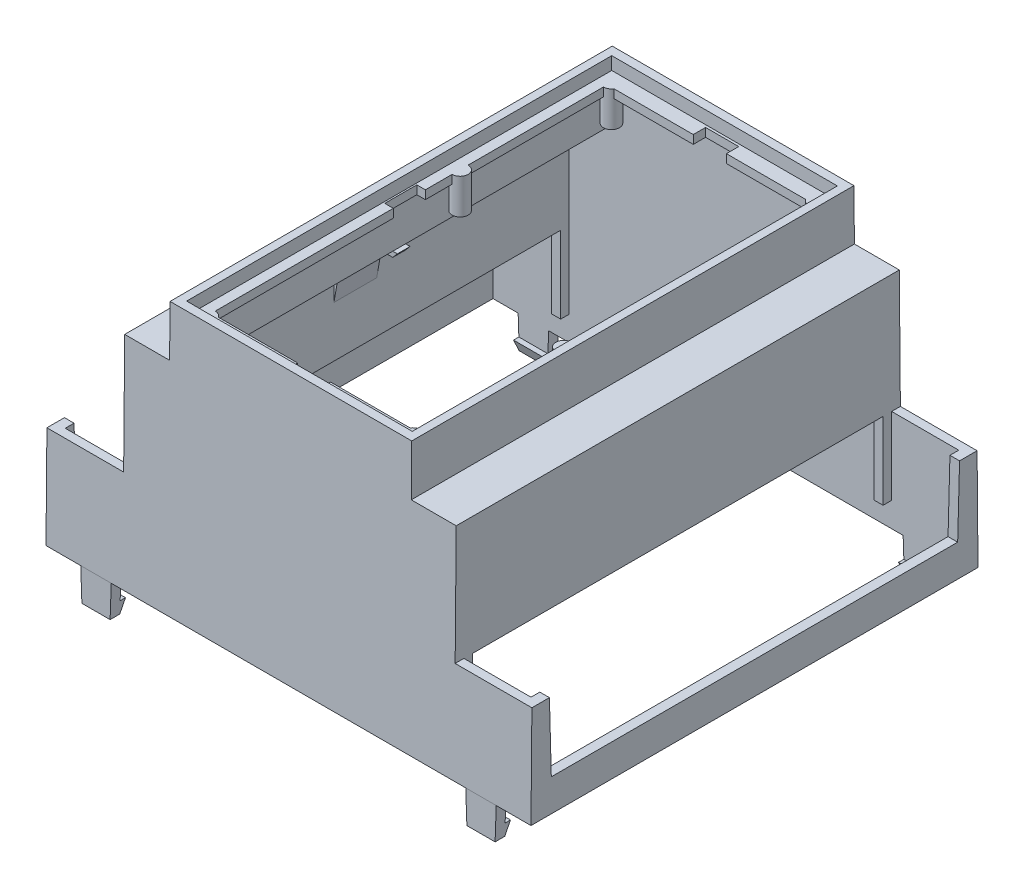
SolidWorks part; units mm, degrees
ref_plane "Спереди" through (0, 0, 0) normal (0, 0, 1) x (1, 0, 0)
ref_plane "Сверху" through (0, 0, 0) normal (0, 1, 0) x (1, 0, 0)
ref_plane "Справа" through (0, 0, 0) normal (1, 0, 0) x (0, 0, -1)
sketch "Эскиз2" plane through (0, 0, 0) normal (0, 0, 1) x (1, 0, 0)
  line L0 (-45.35, 0) -> (45.35, 0)
  line L1 (45.35, 0) -> (45.35, 25)
  line L2 (45.35, 25) -> (31, 25)
  line L3 (31, 25) -> (31, 47.2)
  line L4 (31, 47.2) -> (22.6, 47.2)
  line L5 (22.6, 47.2) -> (22.6, 56.7)
  line L6 (22.6, 56.7) -> (-22.6, 56.7)
  line L7 (-22.6, 56.7) -> (-22.6, 47.2)
  line L8 (-22.6, 47.2) -> (-31, 47.2)
  line L9 (-31, 47.2) -> (-31, 25)
  line L10 (-31, 25) -> (-45.35, 25)
  line L11 (-45.35, 25) -> (-45.35, 0)
  line L12 (0, 0) -> (0, 56.7) construction
  line L13 (-45.35, 6) -> (-38.85, 6)
  line L14 (-38.85, 6) -> (-38.6405, 0)
  line L15 (-33.3595, 0) -> (-33.15, 6)
  line L16 (-33.15, 6) -> (33.15, 6)
  line L17 (33.15, 6) -> (33.3595, 0)
  line L18 (38.6405, 0) -> (38.85, 6)
  line L19 (38.85, 6) -> (45.35, 6)
  line L20 (-36, 6) -> (-36, 0) construction
  dimension "D1" = 56.7
  dimension "D2" = 47.2
  dimension "D3" = 25
  dimension "D4" = 90.7
  dimension "D5" = 62
  dimension "D6" = 45.2
  dimension "D7" = 6
  dimension "D8" = 5.7
  dimension "D9" = 92
  dimension "D10" = 9.35
extrude "Бобышка-Вытянуть1" add sketch "Эскиз2" along normal mid plane 83.6 contours L18 L19 L1 L2 L3 L4 L5 L6 L7 L8 L9 L10 L11 L13 L14 L0 L15 L16 L17
sketch "Эскиз3" plane through (0, 0, 0) normal (1, 0, 0) x (0, 0, -1)
  line L0 (-40, 10.6) -> (40, 10.6)
  line L1 (-41.8, 6) -> (41.8, 6) construction
  line L2 (40, 10.6) -> (40, 2.2)
  line L3 (40, 2.2) -> (39, 2.2)
  line L4 (39, 2.2) -> (40, 0)
  line L5 (-41.8, 0) -> (41.8, 0) construction
  line L6 (40, 0) -> (-40, 0)
  line L7 (-40, 0) -> (-39, 2.2)
  line L8 (-39, 2.2) -> (-40, 2.2)
  line L9 (-40, 2.2) -> (-40, 10.6)
  line L10 (0, 0) -> (0, 6) construction
  line L11 (-41.8, 0) -> (-41.8, 6) construction
  dimension "D1" = 1.8
  dimension "D2" = 3.8
  dimension "D3" = 2.8
  dimension "D4" = 4.6
extrude "Вырез-Вытянуть1" cut sketch "Эскиз3" against normal mid plane 87.1
sketch "Эскиз4" plane through (0, 25, 0) normal (0, 1, 0) x (1, 0, 0)
  line L0 (31, -41.8) -> (31, 41.8) construction
  line L1 (31, 40) -> (43.55, 40)
  line L2 (31, 40) -> (31, -40)
  line L3 (31, -40) -> (43.55, -40)
  line L4 (43.55, 40) -> (43.55, -40)
  line L5 (-31, -41.8) -> (-31, 41.8) construction
  line L6 (-31, 40) -> (-43.55, 40)
  line L7 (-31, 40) -> (-31, -40)
  line L8 (-31, -40) -> (-43.55, -40)
  line L9 (-43.55, 40) -> (-43.55, -40)
  line L10 (45.35, 41.8) -> (31, 41.8) construction
  line L11 (45.35, -41.8) -> (45.35, 41.8) construction
  line L12 (45.35, -41.8) -> (31, -41.8) construction
  line L13 (-31, 41.8) -> (-45.35, 41.8) construction
  line L14 (-31, -41.8) -> (-45.35, -41.8) construction
  line L15 (-45.35, -41.8) -> (-45.35, 41.8) construction
  dimension "D1" = 1.8
  dimension "D2" = 1.8
  dimension "D3" = 1.8
  dimension "D4" = 1.8
  dimension "D5" = 1.8
  dimension "D6" = 1.8
extrude "Вырез-Вытянуть2" cut sketch "Эскиз4" against normal up to surface (19 mm away)
sketch "Эскиз5" plane through (0, 0, 0) normal (1, 0, 0) x (0, 0, -1)
  line L0 (-38.3518, 25) -> (-38, 12)
  line L1 (-41.8, 25) -> (41.8, 25) construction
  line L2 (-38, 12) -> (38, 12)
  line L3 (38, 12) -> (38.3518, 25)
  line L4 (38.3518, 25) -> (-38.3518, 25)
  line L5 (0, 6) -> (0, 47.2) construction
  line L6 (-41.8, 6) -> (41.8, 6) construction
  line L7 (-41.8, 47.2) -> (41.8, 47.2) construction
  dimension "D1" = 91.55
  dimension "D2" = 76
  dimension "D3" = 6
extrude "Вырез-Вытянуть3" cut sketch "Эскиз5" against normal mid plane 92
sketch "Эскиз6" plane through (0, 10.6, 0) normal (0, -1, 0) x (1, 0, 0)
  line L0 (-31, 40) -> (-31, -40) construction
  line L1 (-31, -38.4) -> (31, -38.4)
  line L2 (-31, -38.4) -> (-31, 38.4)
  line L3 (-31, 38.4) -> (31, 38.4)
  line L4 (31, -38.4) -> (31, 38.4)
  line L5 (31, -40) -> (31, 40) construction
  line L6 (-33.15, 41.8) -> (33.15, 41.8) construction
  line L7 (-33.15, -41.8) -> (33.15, -41.8) construction
  dimension "D1" = 3.4
  dimension "D2" = 3.4
extrude "Вырез-Вытянуть4" cut sketch "Эскиз6" against normal up to surface (14.4 mm away)
sketch "Эскиз7" plane through (0, 10.6, 0) normal (0, -1, 0) x (1, 0, 0)
  line L0 (33.15, -40) -> (-33.15, -40) construction
  line L1 (-29.3, -40) -> (29.3, -40)
  line L2 (-29.3, -40) -> (-29.3, 40)
  line L3 (-29.3, 40) -> (29.3, 40)
  line L4 (29.3, -40) -> (29.3, 40)
  line L5 (-33.15, 40) -> (33.15, 40) construction
  line L6 (-31, -38.4) -> (-31, 38.4) construction
  line L7 (31, 38.4) -> (31, -38.4) construction
  dimension "D1" = 1.7
  dimension "D2" = 1.7
extrude "Вырез-Вытянуть5" cut sketch "Эскиз7" against normal up to surface (14.4 mm away)
sketch "Эскиз8" plane through (0, 25, 0) normal (0, -1, 0) x (1, 0, 0)
  line L1 (-29.3, -40) -> (29.3, -40)
  line L2 (-29.3, -40) -> (-29.3, 40)
  line L3 (-29.3, 40) -> (29.3, 40)
  line L4 (29.3, -40) -> (29.3, 40)
extrude "Вырез-Вытянуть6" cut sketch "Эскиз8" against normal blind 20.5
sketch "Эскиз9" plane through (0, 45.5, 0) normal (0, -1, 0) x (1, 0, 0)
  line L0 (33.15, -40) -> (-33.15, -40) construction
  line L1 (-21.1, -40) -> (21.1, -40)
  line L2 (-21.1, -40) -> (-21.1, 40)
  line L3 (-21.1, 40) -> (21.1, 40)
  line L4 (21.1, -40) -> (21.1, 40)
  line L5 (-33.15, 40) -> (33.15, 40) construction
  line L6 (0, -40) -> (0, 40) construction
  line L7 (-22.6, 41.8) -> (-22.6, -41.8) construction
  dimension "D1" = 1.5
extrude "Вырез-Вытянуть7" cut sketch "Эскиз9" against normal blind 7.2 contours L4 L3 L2 L1
sketch "Эскиз16" plane through (0, 0, 0) normal (1, 0, 0) x (0, 0, -1)
  line L0 (0, 0) -> (0, 56.7) construction
  line L1 (-41.8, 56.7) -> (41.8, 56.7) construction
  line L2 (-41.8, 56.7) -> (-41.8, 6)
  line L3 (-41.8, 6) -> (-41.35, 56.7)
  line L4 (-41.35, 56.7) -> (-41.8, 56.7)
  line L5 (41.35, 56.7) -> (41.8, 56.7)
  line L6 (41.8, 56.7) -> (41.8, 6)
  line L7 (41.8, 6) -> (41.35, 56.7)
  dimension "D1" = 82.7
extrude "Вырез-Вытянуть10" cut sketch "Эскиз16" against normal mid plane 92
sketch "Эскиз10" plane through (0, 56.7, 0) normal (0, 1, 0) x (1, 0, 0)
  line L0 (22.6, -41.35) -> (22.6, 41.35) construction
  line L1 (21.1, 39.75) -> (-21.1, 39.75)
  line L2 (21.1, 39.75) -> (21.1, -39.75)
  line L3 (21.1, -39.75) -> (-21.1, -39.75)
  line L4 (-21.1, 39.75) -> (-21.1, -39.75)
  line L5 (-22.6, -41.35) -> (-22.6, 41.35) construction
  line L8 (-22.6, 41.35) -> (22.6, 41.35) construction
  line L9 (-22.6, -41.35) -> (22.6, -41.35) construction
  dimension "D1" = 1.5
  dimension "D2" = 1.5
  dimension "D3" = 1.6
  dimension "D4" = 1.6
extrude "Вырез-Вытянуть8" cut sketch "Эскиз10" against normal blind 2.4
sketch "Эскиз11" plane through (0, 54.3, 0) normal (0, 1, 0) x (1, 0, 0)
  line L0 (-3.1, 39.3) -> (3.1, 39.3)
  line L1 (3.1, 39.3) -> (3.1, 37)
  line L2 (3.1, 37) -> (19.2, 37)
  line L3 (19.2, 37) -> (19.2, 3)
  line L4 (19.2, 3) -> (20.8, 3)
  line L5 (20.8, 3) -> (20.8, -3)
  line L6 (20.8, -3) -> (19.2, -3)
  line L7 (19.2, -3) -> (19.2, -37)
  line L8 (19.2, -37) -> (3.1, -37)
  line L9 (3.1, -37) -> (3.1, -39.3)
  line L10 (3.1, -39.3) -> (-3.1, -39.3)
  line L11 (-3.1, -39.3) -> (-3.1, -37)
  line L12 (-3.1, -37) -> (-19.2, -37)
  line L13 (-19.2, -37) -> (-19.2, -3)
  line L14 (-19.2, -3) -> (-20.8, -3)
  line L15 (-20.8, -3) -> (-20.8, 3)
  line L16 (-20.8, 3) -> (-19.2, 3)
  line L17 (-19.2, 3) -> (-19.2, 37)
  line L18 (-19.2, 37) -> (-3.1, 37)
  line L19 (-3.1, 37) -> (-3.1, 39.3)
  line L20 (21.1, 0) -> (-21.1, 0) construction
  line L21 (21.1, -39.75) -> (21.1, 39.75) construction
  line L22 (-21.1, 39.75) -> (-21.1, -39.75) construction
  line L23 (0, 39.75) -> (0, -39.75) construction
  line L24 (21.1, 39.75) -> (-21.1, 39.75) construction
  line L25 (-21.1, -39.75) -> (21.1, -39.75) construction
  dimension "D1" = 38.4
  dimension "D2" = 41.6
  dimension "D3" = 74
  dimension "D4" = 78.6
  dimension "D5" = 6
  dimension "D6" = 6.2
extrude "Вырез-Вытянуть9" cut sketch "Эскиз11" against normal blind 2.4
sketch "Эскиз12" plane through (0, 0, 0) normal (0, 0, 1) x (1, 0, 0)
  line L0 (-29.3, 45.5) -> (-29.3, 44.5)
  line L1 (-29.3, 45.5) -> (-29.3, 10.6) construction
  line L2 (-29.3, 44.5) -> (-21.1, 44.5)
  line L3 (-21.1, 44.5) -> (-20.25, 45.5)
  line L4 (-20.25, 45.5) -> (-29.3, 45.5)
  line L5 (29.3, 45.5) -> (20.25, 45.5)
  line L6 (20.25, 45.5) -> (21.1, 44.5)
  line L7 (21.1, 44.5) -> (29.3, 44.5)
  line L8 (29.3, 45.5) -> (29.3, 10.6) construction
  line L9 (29.3, 44.5) -> (29.3, 45.5)
  line L10 (0, 56.7) -> (0, 6) construction
  line L11 (21.1, 56.7) -> (-21.1, 56.7) construction
  line L12 (33.15, 6) -> (-33.15, 6) construction
  dimension "D1" = 1
  dimension "D2" = 40.5
  dimension "D3" = 8.2
extrude "Бобышка-Вытянуть2" add sketch "Эскиз12" along normal mid plane 2.4
sketch "Эскиз13" plane through (0, 0, 0) normal (0, 0, 1) x (1, 0, 0)
  line L0 (-29.3, 34.5) -> (-28.5, 39.1)
  line L1 (-29.3, 45.5) -> (-29.3, 10.6) construction
  line L2 (-28.5, 39.1) -> (-29.3, 39.1)
  line L3 (-29.3, 39.1) -> (-29.3, 34.5)
  line L4 (29.3, 39.1) -> (28.5, 39.1)
  line L5 (29.3, 45.5) -> (29.3, 10.6) construction
  line L6 (28.5, 39.1) -> (29.3, 34.5)
  line L7 (29.3, 34.5) -> (29.3, 39.1)
  line L8 (0, 52.7) -> (0, 6) construction
  line L9 (-3.1, 52.7) -> (3.1, 52.7) construction
  line L10 (33.15, 6) -> (-33.15, 6) construction
  line L12 (-20.25, 45.5) -> (-21.1, 45.5) construction
  dimension "D1" = 6.4
  dimension "D2" = 0.8
  dimension "D3" = 11
extrude "Бобышка-Вытянуть3" add sketch "Эскиз13" along normal mid plane 8
sketch "Эскиз14" plane through (0, 45.5, 0) normal (0, -1, 0) x (1, 0, 0)
  line L0 (0, 0) -> (-29.3, 0) construction
  line L1 (-29.3, 38.4) -> (-29.3, -38.4) construction
  line L2 (0, 0) -> (0, 40) construction
  line L3 (-33.15, 40) -> (33.15, 40) construction
  line L4 (33.15, -40) -> (-33.15, -40) construction
  line L5 (-27.5, -37) -> (27.5, -37) construction
  line L6 (-27.5, -37) -> (-27.5, 37) construction
  line L7 (-27.5, 37) -> (27.5, 37) construction
  line L8 (27.5, -37) -> (27.5, 37) construction
  circle A0 centre (-27.5, -37) radius 1.3
  circle A1 centre (-27.5, 37) radius 1.3
  circle A2 centre (27.5, -37) radius 1.3
  circle A3 centre (27.5, 37) radius 1.3
  dimension "D3" = 2.6
  dimension "D1" = 3
  dimension "D2" = 1.8
extrude "Бобышка-Вытянуть4" add sketch "Эскиз14" along normal blind 4.4 draft 3
sketch "Эскиз15" plane through (0, 54.3, 0) normal (0, 1, 0) x (1, 0, 0)
  line L0 (-20.25, 0) -> (20.25, 0) construction
  line L1 (19.2, 37.8) -> (-19.2, 37.8) construction
  line L2 (19.2, 37.8) -> (19.2, -37.8) construction
  line L3 (19.2, -37.8) -> (-19.2, -37.8) construction
  line L4 (-19.2, 37.8) -> (-19.2, -37.8) construction
  line L5 (-20.25, -1.2) -> (-20.25, 1.2) construction
  line L6 (20.25, -1.2) -> (20.25, 1.2) construction
  line L7 (0, 39.3) -> (0, -39.3) construction
  line L8 (3.1, 39.3) -> (-3.1, 39.3) construction
  line L9 (-3.1, -39.3) -> (3.1, -39.3) construction
  line L10 (19.2, 3) -> (19.2, 37) construction
  line L12 (-21.1, 40) -> (21.1, 40) construction
  circle A0 centre (19.2, 37.8) radius 1.5
  circle A1 centre (-19.2, 37.8) radius 1.5
  circle A2 centre (-19.2, -37.8) radius 1.5
  circle A3 centre (19.2, -37.8) radius 1.5
  circle A4 centre (19.2, -9.5) radius 1.5
  circle A5 centre (-19.2, 9.5) radius 1.5
  dimension "D2" = 3
  dimension "D1" = 2.2
  dimension "D3" = 9.5
  dimension "D4" = 9.5
extrude "Бобышка-Вытянуть5" add sketch "Эскиз15" against normal blind 6.6
